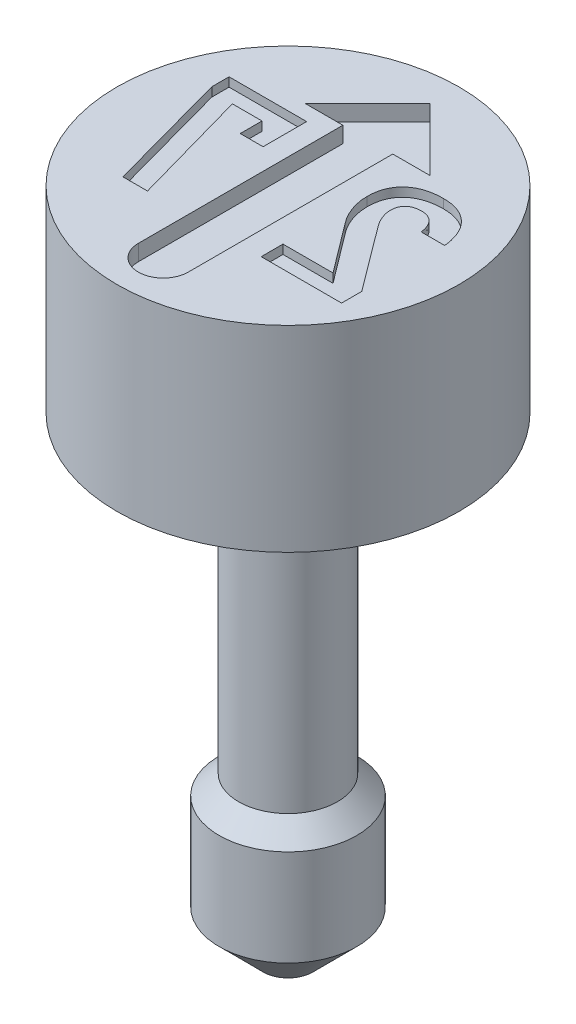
SolidWorks part; units mm, degrees
ref_plane "Front Plane" through (0, 0, 0) normal (0, 0, 1) x (1, 0, 0)
ref_plane "Top Plane" through (0, 0, 0) normal (0, 1, 0) x (1, 0, 0)
ref_plane "Right Plane" through (0, 0, 0) normal (1, 0, 0) x (0, 0, -1)
sketch "Sketch1" plane through (0, 0, 0) normal (0, 0, 1) x (1, 0, 0)
  line L0 (0, 17.018) -> (4.3561, 17.018)
  line L1 (0, -4.7917) -> (0, 4.7917) construction
  line L2 (4.3561, 17.018) -> (4.3561, 12.0142)
  line L3 (4.3561, 12.0142) -> (1.2573, 12.0142)
  line L4 (1.2573, 12.0142) -> (1.2573, 4.064)
  line L5 (1.2573, 4.064) -> (1.7526, 3.5687)
  line L6 (1.7526, 3.5687) -> (1.7526, 1.1176)
  line L7 (1.7526, 1.1176) -> (0.635, 0)
  line L8 (4.7917, 0) -> (-4.7917, 0) construction
  line L9 (0.635, 0) -> (0, 0)
  line L10 (0, 0) -> (0, 17.018)
  line L11 (0, 0) -> (0, 64.9194) construction
  dimension "D1" = 17.018
  dimension "D2" = 4.064
  dimension "D3" = 1.1176
  dimension "D4" = 45
  dimension "D5" = 3.5052
  dimension "D6" = 8.7122
  dimension "D7" = 2.5146
  dimension "D8" = 5.0038
revolve "Revolve1" add sketch "Sketch1" angle 360 about L11
sketch "Sketch2" plane through (0, 17.018, 0) normal (0, 1, 0) x (1, 0, 0)
  line L1 (0.635, -3.175) -> (0.635, 2.032)
  line L2 (-0.635, -3.175) -> (-0.635, 2.032)
  line L3 (0, -4.7917) -> (0, 4.7917) construction
  line L4 (-0.635, 2.032) -> (-1.5875, 2.032)
  line L5 (0.635, 2.032) -> (1.5875, 2.032)
  line L6 (1.5875, 2.032) -> (0, 3.6195)
  line L7 (0, 3.6195) -> (-1.5875, 2.032)
  line L8 (-4.7917, 0) -> (4.7917, 0) construction
  arc A0 (-0.635, -3.175) -> (0.635, -3.175) centre (0, -3.175) ccw
  dimension "D6" = 3.175
  dimension "D1" = 1.27
  dimension "D2" = 0.635
  dimension "D3" = 3.175
  dimension "D4" = 1.5875
  dimension "D5" = 45
  dimension "D7" = 2.032
extrude "Cut-Extrude1" cut sketch "Sketch2" against normal blind 0.4064
sketch "Sketch3" plane through (0, 17.018, 0) normal (0, 1, 0) x (1, 0, 0)
  text T0 "2 7" font "Bahnschrift SemiBold" height 3.556
  dimension "D1" = 1.905
  dimension "D2" = 3.556
extrude "Cut-Extrude2" cut sketch "Sketch3" against normal blind 0.2286
